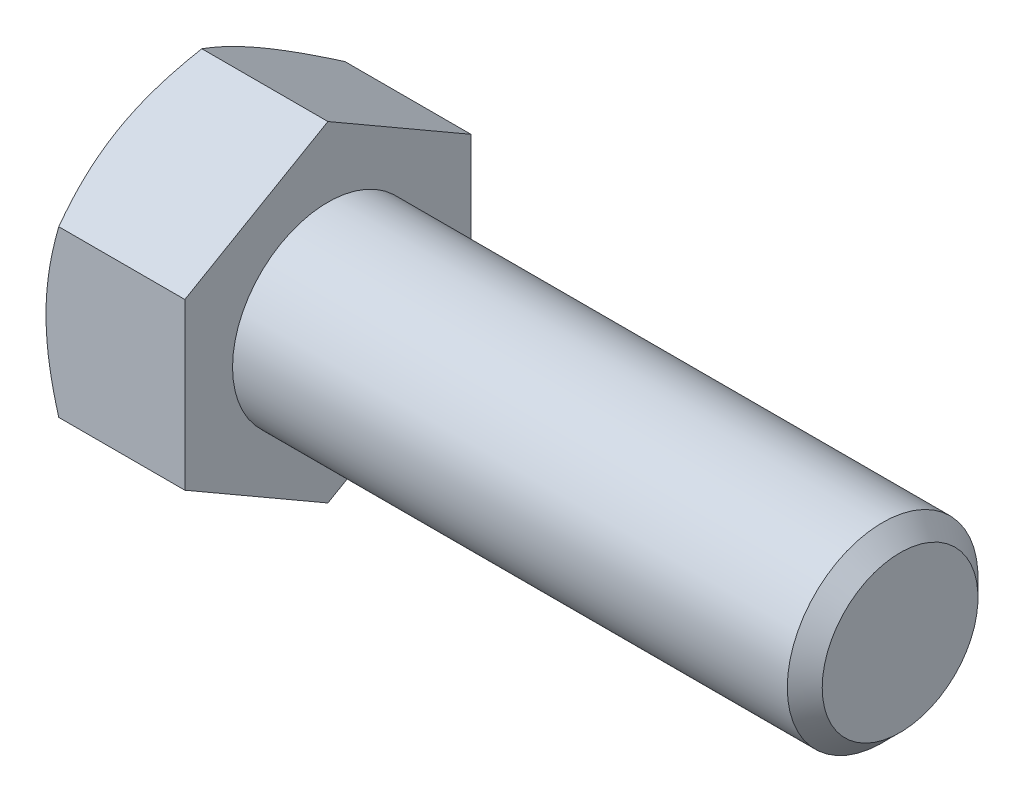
SolidWorks part; units mm, degrees
ref_plane "Plane1" through (0, 0, 0) normal (0, 0, 1) x (1, 0, 0)
ref_plane "Plane2" through (0, 0, 0) normal (0, 1, 0) x (1, 0, 0)
ref_plane "Plane3" through (0, 0, 0) normal (1, 0, 0) x (0, 0, -1)
sketch "Sketch1" plane through (0, 0, 0) normal (1, 0, 0) x (0, 0, -1)
  line L0 (9.525, 5.4993) -> (9.525, -5.4993)
  line L1 (-9.525, 5.4993) -> (-9.525, -5.4993)
  line L2 (9.525, -5.4993) -> (0, -10.9985)
  line L3 (0, -10.9985) -> (-9.525, -5.4993)
  line L4 (9.525, 5.4993) -> (0, 10.9985)
  line L5 (0, 10.9985) -> (-9.525, 5.4993)
  dimension "Width_flats" = 19.05
  dimension "D2" = 120
  dimension "D3" = 9.525
  dimension "D4" = 9.525
  dimension "D5" = 9.525
extrude "BaseHead" add sketch "Sketch1" along normal blind 9.2456
sketch "BodySke" plane through (0, 0, 0) normal (0, 0, 1) x (1, 0, 0)
  line L0 (0, 5.4993) -> (0, -5.4993) construction
  line L1 (0, 0) -> (47.3456, 0)
  line L2 (0, 0) -> (0, 6.35)
  line L3 (0, 6.35) -> (46.1823, 6.35)
  line L4 (47.3456, 0) -> (47.3456, 5.1867)
  line L5 (9.2456, 10.9985) -> (9.2456, 5.4993) construction
  line L6 (47.3456, 5.1867) -> (46.1823, 6.35)
  line L7 (0, 0) -> (96.52, 0) construction
  line L8 (47.3456, -5.1867) -> (46.1823, -6.35) construction
  line L9 (0, -6.35) -> (46.1823, -6.35) construction
  line L10 (11.1989, 15.24) -> (11.1989, -2.54) construction
  line L11 (15.5956, 15.24) -> (15.5956, -2.54) construction
  line L12 (9.2456, 5.4993) -> (9.2456, -5.4993) construction
  dimension "Length" = 38.1
  dimension "Body_ch_ang" = 45
  dimension "Diameter" = 12.7
  dimension "Minor_dia" = 10.3734
  dimension "Advance" = 1.9533
  dimension "Thread_nom" = 31.75
revolve "BaseBody" add sketch "BodySke" angle 360 about L7
sketch "Sketch3" plane through (0, 0, 0) normal (0, 0, 1) x (1, 0, 0)
  line L0 (0, 9.525) -> (4.5169, 17.3485)
  line L1 (0, 10.9985) -> (0, 5.4993) construction
  line L2 (4.5169, 17.3485) -> (4.5169, 23.6985)
  line L3 (4.5169, 23.6985) -> (-12.7, 23.6985)
  line L4 (-12.7, 23.6985) -> (-12.7, 9.525)
  line L5 (-12.7, 9.525) -> (0, 9.525)
  line L6 (0, 0) -> (99.06, 0) construction
  line L7 (9.2456, 10.9985) -> (0, 10.9985) construction
  dimension "D1" = 9.525
  dimension "D2" = 6.35
  dimension "D3" = 12.7
  dimension "D4" = 6.35
  dimension "Head_ch_ang" = 30
revolve "HeadChamfer" cut sketch "Sketch3" angle 360 about L6
fillet "HeadFillet" [suppressed] radius 0.762
sketch "ThdSchSke" plane through (0, 0, 0) normal (0, 0, 1) x (1, 0, 0)
  line L0 (15.5956, -5.1867) -> (14.781, -6.35)
  line L1 (15.5956, -5.1867) -> (16.4102, -6.35)
  line L2 (16.4102, -6.35) -> (16.4102, -7.9375)
  line L3 (-3.175, 0) -> (5.1513, 0) construction
  line L5 (16.4102, -7.9375) -> (14.781, -7.9375)
  line L6 (14.781, -7.9375) -> (14.781, -6.35)
  dimension "Thread_minor" = 10.3734
  dimension "Diameter" = 12.7
  dimension "Start" = 15.5956
  dimension "SideAngle" = 55
  dimension "VeeAngle" = 70
  dimension "Overcut" = 15.875
revolve "ThreadSchematic" [suppressed] cut sketch "ThdSchSke" angle 360 about L3
pattern_linear "ThdSchPat" [suppressed]
equation "\"D3@Sketch1\" = \"Width_flats@Sketch1\" / 2"
equation "\"D4@Sketch1\" = \"D3@Sketch1\""
equation "\"D5@Sketch1\" = \"D4@Sketch1\""
equation "\"Thread_minor@ThreadCosmetic\" = \"Minor_dia@BodySke\""
equation "\"D1@Sketch3\" = \"Width_flats@Sketch1\" / 2"
equation "\"Thread_length@ThreadCosmetic\" = ((sgn( (\"Length@BodySke\" - \"Advance@BodySke\" ) - \"Thread_nom@BodySke\" )-1)*( (\"Length@BodySke\" - \"Advance@BodySke\" ) - \"Thread_nom@BodySke\" ))/-2+ \"Thread_nom@BodySke\""
equation "\"Thread_minor@ThdSchSke\" = \"Minor_dia@BodySke\""
equation "\"Diameter@ThdSchSke\" = \"Diameter@BodySke\""
equation "\"Overcut@ThdSchSke\" = \"Diameter@BodySke\" * 1.25"
equation "\"Start@ThdSchSke\" = \"Head_ht@BaseHead\" + \"Length@BodySke\" - \"Thread_length@ThreadCosmetic\"  '---Non-countersunk---"
equation "\"Num_threads@ThdSchPat\" = int( \"Thread_length@ThreadCosmetic\" / \"Advance@BodySke\" + 0.999 )  + 1"
equation "\"Advance@ThdSchPat\" = \"Thread_length@ThreadCosmetic\" /  (\"Num_threads@ThdSchPat\" - 1) 'relax it"
equation "\"Num_threads@ThdSchPat\" = \"Num_threads@ThdSchPat\" - sgn( \"Num_threads@ThdSchPat\" - 1) '---chamfered tips only---"
